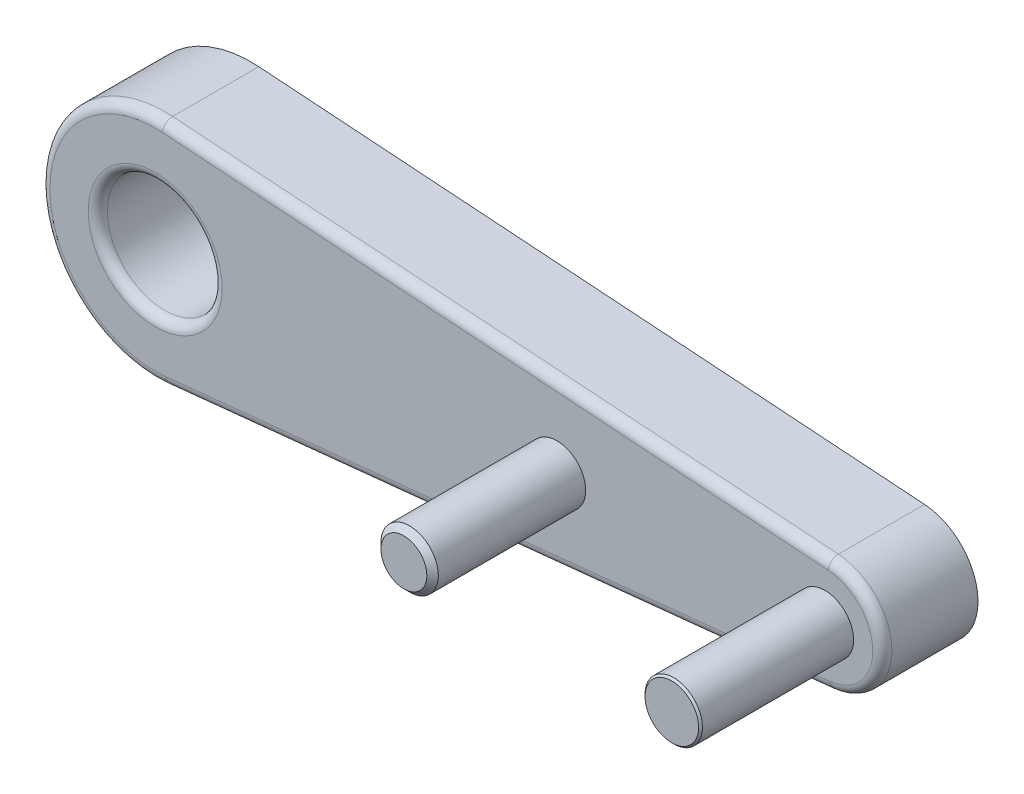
SolidWorks part; units mm, degrees
ref_plane "Plan de face" through (0, 0, 0) normal (0, 0, 1) x (1, 0, 0)
ref_plane "Plan de dessus" through (0, 0, 0) normal (0, 1, 0) x (1, 0, 0)
ref_plane "Plan de droite" through (0, 0, 0) normal (1, 0, 0) x (0, 0, -1)
sketch "Esquisse1" plane through (0, 0, 0) normal (0, 0, 1) x (1, 0, 0)
  line L0 (4.1543, 59.856) -> (352.0294, 35.7117)
  line L1 (6.13, -59.686) -> (353.0172, -24.0593)
  arc A0 (4.1543, 59.856) -> (6.13, -59.686) centre (0, 0) ccw
  arc A1 (353.0172, -24.0593) -> (352.0294, 35.7117) centre (349.9522, 5.7837) ccw
  circle A2 centre (0, 0) radius 30
  dimension "D1" = 120
  dimension "D2" = 60
  dimension "D4" = 60
  dimension "D3" = 350
extrude "Extrusion1" add sketch "Esquisse1" along normal blind 50
fillet "Congé1" radius 5 5 edges at (178.0918, 47.7839, 50) (379.9481, 6.2794, 50) (179.5736, -41.8727, 50) (-59.9918, -0.9915, 50) (30, 0, 50)
sketch "Esquisse2" plane through (0, 0, 50) normal (0, 0, 1) x (1, 0, 0)
  line L0 (0, 0) -> (349.9522, 5.7837) construction
  circle A0 centre (209.9522, 3.4699) radius 15
  dimension "D1" = 30
  dimension "D2" = 140
extrude "Extrusion2" add sketch "Esquisse2" along normal blind 80
chamfer "Chanfrein1" distance 3 angle 45 1 edges at (224.9522, 3.4699, 130)
sketch "Esquisse4" plane through (0, 0, 50) normal (0, 0, 1) x (1, 0, 0)
  circle A0 centre (349.9522, 5.7837) radius 15
extrude "Extrusion3" add sketch "Esquisse4" along normal blind 80
chamfer "Chanfrein2" distance 1 angle 45 1 edges at (364.9522, 5.7837, 130)
